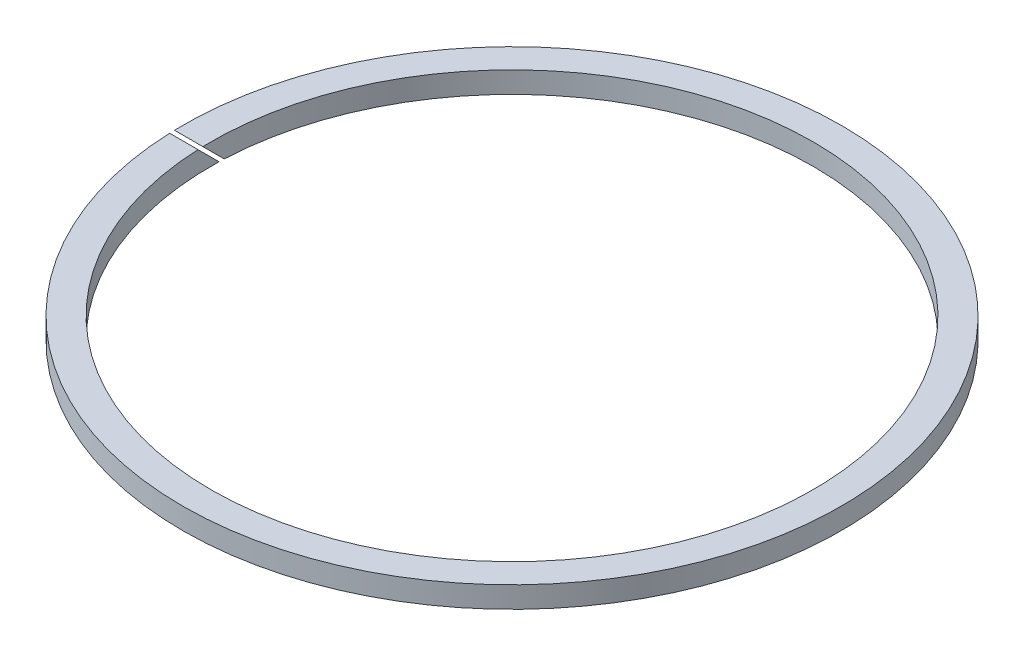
SolidWorks part; units mm, degrees
ref_plane "Front" through (0, 0, 0) normal (0, 0, 1) x (1, 0, 0)
ref_plane "Top" through (0, 0, 0) normal (0, 1, 0) x (1, 0, 0)
ref_plane "Right" through (0, 0, 0) normal (1, 0, 0) x (0, 0, -1)
sketch "Sketch1" plane through (0, 0, 0) normal (0, 1, 0) x (1, 0, 0)
  circle A0 centre (0, 0) radius 46.5
  circle A1 centre (0, 0) radius 42.5
  dimension "D1" = 85
  dimension "D2" = 93
extrude "Extrude1" add sketch "Sketch1" along normal mid plane 3
sketch "Sketch2" plane through (0, 0, 0) normal (1, 0, 0) x (0, 0, -1)
  line L0 (-4.0821, 4.0821) -> (4.0821, -4.0821) construction
  line L1 (0, 0) -> (5.3056, 0) construction
  line L2 (-1.8536, 1.5) -> (1.1464, -1.5)
  line L3 (42.5, 1.5) -> (-42.5, 1.5) construction
  line L4 (1.1464, -1.5) -> (1.8536, -1.5)
  line L5 (1.8536, -1.5) -> (-1.1464, 1.5)
  line L6 (-1.1464, 1.5) -> (-1.8536, 1.5)
  line L7 (-46.5, -1.5) -> (46.5, -1.5) construction
  dimension "D1" = 45
  dimension "D2" = 0.5
  dimension "D3" = 0.25
extrude "Cut-Extrude1" cut sketch "Sketch2" against normal through all
